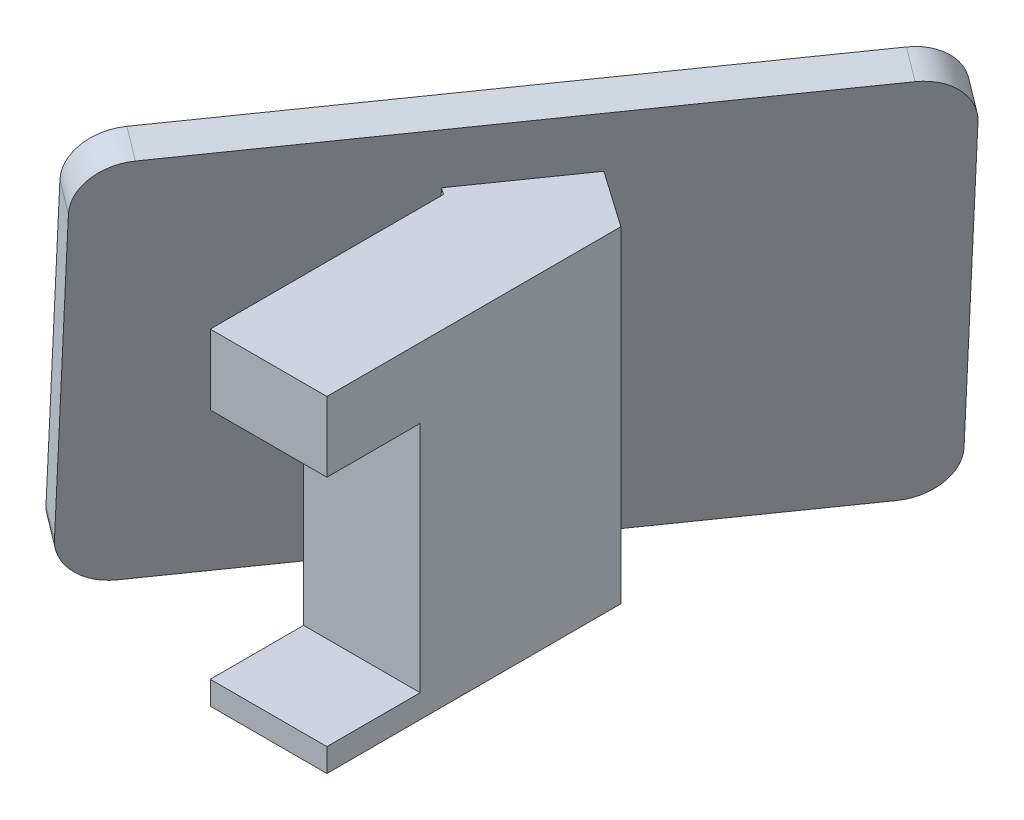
SolidWorks part; units mm, degrees
ref_plane "Front Plane" through (0, 0, 0) normal (0, 0, 1) x (1, 0, 0)
ref_plane "Top Plane" through (0, 0, 0) normal (0, 1, 0) x (1, 0, 0)
ref_plane "Right Plane" through (0, 0, 0) normal (1, 0, 0) x (0, 0, -1)
sketch "Sketch1" plane through (0, 0, 0) normal (1, 0, 0) x (0, 0, -1)
  line L0 (0, -50) -> (0, 50)
  line L1 (0, 50) -> (-40, 50)
  line L2 (-40, 50) -> (-40, 80)
  line L3 (-40, 80) -> (10, 80)
  line L4 (10, 80) -> (10, -60)
  line L5 (10, -60) -> (-40, -60)
  line L6 (-40, -60) -> (-40, -50)
  line L7 (-40, -50) -> (0, -50)
  point P4 (0, 0)
  dimension "D1" = 100
  dimension "D2" = 40
  dimension "D3" = 50
  dimension "D4" = 10
  dimension "D5" = 30
extrude "Boss-Extrude1" add sketch "Sketch1" along normal mid plane 50
sketch "Sketch4" plane through (0, 0, 0) normal (0, 1, 0) x (1, 0, 0)
  line L8 (-25, 10) -> (-25, 60)
  line L9 (-25, 60) -> (-49.5746, 77.2073)
  line L10 (-49.5746, 77.2073) -> (-20.8957, 118.1649)
  line L11 (-20.8957, 118.1649) -> (25, 86.0284)
  line L12 (25, 86.0284) -> (25, 10)
  line L13 (25, 10) -> (-25, 10)
  dimension "D1" = 50
  dimension "D2" = 30
  dimension "D3" = 50
  dimension "D4" = 235
extrude "Boss-Extrude3" add sketch "Sketch4" along normal up to surface and the other way up to surface
chamfer "Chamfer1" distance 150 angle 10 2 edges at (-35.2352, 80, -97.6861) (-35.2352, -60, -97.6861)
sketch "Sketch2" plane through (-30.4829, 5.3827, -81.2991) normal (-0.8067, 0.1736, -0.5649) x (-0.5736, 0, 0.8192)
  line L0 (-10.6976, 75.7684) -> (-10.6976, -66.3913) construction
  line L4 (-150.6976, -79.2316) -> (129.3024, -79.2316)
  line L5 (-150.6976, -79.2316) -> (-150.6976, 100.7684)
  line L6 (-150.6976, 100.7684) -> (129.3024, 100.7684)
  line L7 (129.3024, -79.2316) -> (129.3024, 100.7684)
  line L8 (-150.6976, -79.2316) -> (129.3024, 100.7684) construction
  line L9 (-150.6976, 100.7684) -> (129.3024, -79.2316) construction
  line L13 (14.3024, -66.3913) -> (-35.6976, -66.3913) construction
  line L14 (-35.6976, 75.7684) -> (14.3024, 75.7684) construction
  point P2 (-10.6976, 80)
  point P3 (-10.6976, -59.9618)
  point P4 (0, 0)
  point P6 (-10.6976, 10.7684)
  point P12 (-10.6976, 80.573)
  point P13 (50, 65.5514)
  point P14 (0, 0)
  point P16 (-10.6976, -60)
  dimension "D1" = 280
  dimension "D2" = 180
  dimension "D3" = 65
extrude "Boss-Extrude2" add sketch "Sketch2" along normal blind 15
fillet "Fillet1" radius 20 4 edges at (38.6332, -71.3428, -216.8714) (-121.9682, -71.3428, 12.4912) (-96.3643, 105.9226, 30.4193) (64.2371, 105.9226, -198.9433)
sketch "Sketch3" plane through (-69.7385, 15.0116, -48.8314) normal (-0.8067, 0.1736, -0.5649) x (-0.5736, 0, 0.8192)
  line L8 (-194.8097, 73.6359) -> (-194.8097, -66.3641)
  line L9 (-179.8097, -81.3641) -> (60.1903, -81.3641)
  line L10 (75.1903, -66.3641) -> (75.1903, 73.6359)
  line L11 (60.1903, 88.6359) -> (-179.8097, 88.6359)
  line L12 (-194.8097, 73.6359) -> (-194.8097, -66.3641)
  line L13 (-179.8097, -81.3641) -> (60.1903, -81.3641)
  line L14 (75.1903, -66.3641) -> (75.1903, 73.6359)
  line L15 (60.1903, 88.6359) -> (-179.8097, 88.6359)
  arc A8 (-194.8097, -66.3641) -> (-179.8097, -81.3641) centre (-179.8097, -66.3641) ccw
  arc A9 (60.1903, -81.3641) -> (75.1903, -66.3641) centre (60.1903, -66.3641) ccw
  arc A10 (75.1903, 73.6359) -> (60.1903, 88.6359) centre (60.1903, 73.6359) ccw
  arc A11 (-179.8097, 88.6359) -> (-194.8097, 73.6359) centre (-179.8097, 73.6359) ccw
  arc A12 (-194.8097, -66.3641) -> (-179.8097, -81.3641) centre (-179.8097, -66.3641) ccw
  arc A13 (60.1903, -81.3641) -> (75.1903, -66.3641) centre (60.1903, -66.3641) ccw
  arc A14 (75.1903, 73.6359) -> (60.1903, 88.6359) centre (60.1903, 73.6359) ccw
  arc A15 (-179.8097, 88.6359) -> (-194.8097, 73.6359) centre (-179.8097, 73.6359) ccw
  dimension "D1" = 5
extrude "Cut-Extrude1" cut sketch "Sketch3" against normal blind 1
